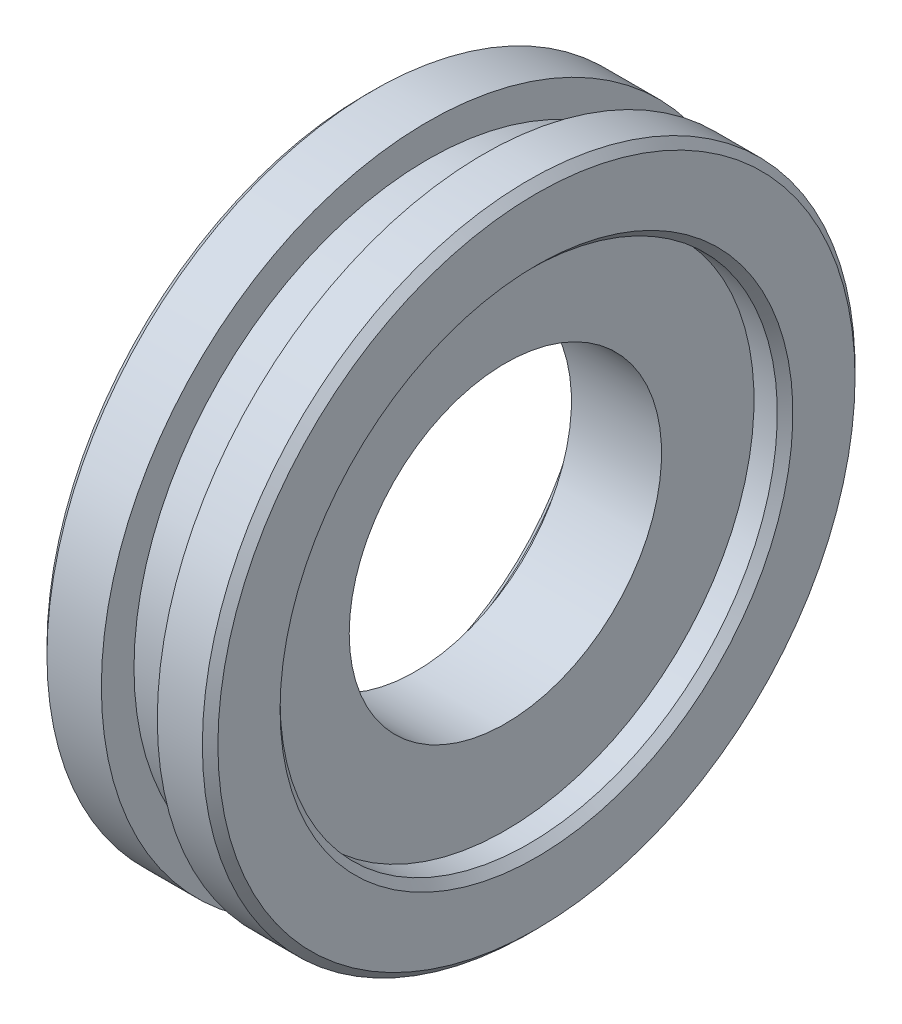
SolidWorks part; units mm, degrees
ref_plane "Plan de face" through (0, 0, 0) normal (0, 0, 1) x (1, 0, 0)
ref_plane "Plan de dessus" through (0, 0, 0) normal (0, 1, 0) x (1, 0, 0)
ref_plane "Plan de droite" through (0, 0, 0) normal (1, 0, 0) x (0, 0, -1)
sketch "Esquisse1" plane through (0, 0, 0) normal (0, 0, 1) x (1, 0, 0)
  line L0 (0, 0) -> (44.1379, 0) construction
  line L1 (0, 21) -> (4, 21)
  line L2 (4, 21) -> (4, 18.9)
  line L3 (4, 18.9) -> (7.6, 18.9)
  line L4 (7.6, 18.9) -> (7.6, 21)
  line L5 (7.6, 21) -> (11, 21)
  line L6 (11, 21) -> (11, 16)
  line L7 (11, 16) -> (9, 16)
  line L8 (9, 16) -> (9, 10.05)
  line L9 (9, 10.05) -> (3.2, 10.05)
  line L10 (3.2, 10.05) -> (3.2, 13.75)
  line L11 (3.2, 13.75) -> (0, 13.75)
  line L12 (0, 13.75) -> (0, 21)
  dimension "D1" = 20.1
  dimension "D2" = 27.5
  dimension "D3" = 3.2
  dimension "D4" = 32
  dimension "D5" = 2
  dimension "D6" = 11
  dimension "D7" = 4
  dimension "D8" = 3.6
  dimension "D9" = 42
  dimension "D10" = 37.8
revolve "Révolution1" add sketch "Esquisse1" angle 360 about L0
chamfer "Chanfrein1" distance 0.5 angle 45 4 edges at (11, 0, 16) (11, 0, 21) (0, 0, 21) (0, 0, 13.75)
